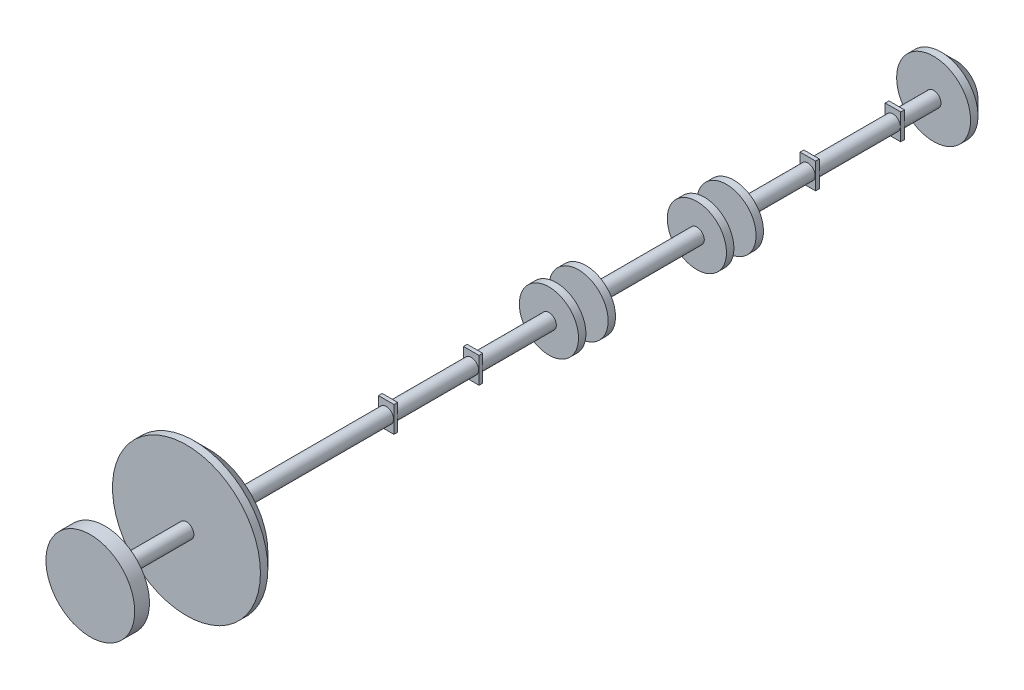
SolidWorks part; units mm, degrees
ref_plane "Plan de face" through (0, 0, 0) normal (0, 0, 1) x (1, 0, 0)
ref_plane "Plan de dessus" through (0, 0, 0) normal (0, 1, 0) x (1, 0, 0)
ref_plane "Plan de droite" through (0, 0, 0) normal (1, 0, 0) x (0, 0, -1)
sketch "Esquisse1" plane through (0, 0, 0) normal (0, 0, 1) x (1, 0, 0)
  circle A0 centre (0, 0) radius 10
  dimension "D1" = 20
extrude "Extrusion1" add sketch "Esquisse1" along normal blind 240
sketch "Esquisse2" plane through (0, 0, 0) normal (0, 0, -1) x (-1, 0, 0)
  line L1 (-10.5, 17.5) -> (10.5, 17.5)
  line L2 (-10.5, 17.5) -> (-10.5, -17.5)
  line L3 (-10.5, -17.5) -> (10.5, -17.5)
  line L4 (10.5, 17.5) -> (10.5, -17.5)
  dimension "D1" = 21
  dimension "D2" = 10.5
  dimension "D3" = 35
  dimension "D4" = 17.5
extrude "Extrusion2" add sketch "Esquisse2" along normal blind 5
sketch "Esquisse3" plane through (0, 0, -5) normal (0, 0, -1) x (-1, 0, 0)
  circle A0 centre (0, 0) radius 10 construction
  circle A1 centre (0, 0) radius 10
extrude "Extrusion3" add sketch "Esquisse3" along normal blind 110
sketch "Esquisse4" plane through (0, 0, -115) normal (0, 0, -1) x (-1, 0, 0)
  line L4 (-10.5, 17.5) -> (-10.5, -17.5)
  line L5 (-10.5, -17.5) -> (10.5, -17.5)
  line L6 (10.5, -17.5) -> (10.5, 17.5)
  line L7 (10.5, 17.5) -> (-10.5, 17.5)
  line L8 (-10.5, 17.5) -> (-10.5, -17.5)
  line L9 (-10.5, -17.5) -> (10.5, -17.5)
  line L10 (10.5, -17.5) -> (10.5, 17.5)
  line L11 (10.5, 17.5) -> (-10.5, 17.5)
  dimension "D1" = 0
extrude "Extrusion4" add sketch "Esquisse4" along normal blind 5
sketch "Esquisse5" plane through (0, 0, -120) normal (0, 0, -1) x (-1, 0, 0)
  circle A0 centre (0, 0) radius 10 construction
  circle A1 centre (0, 0) radius 10
extrude "Extrusion5" add sketch "Esquisse5" along normal blind 100
sketch "Esquisse7" plane through (0, 0, 240) normal (0, 0, 1) x (1, 0, 0)
  circle A0 centre (0, 0) radius 100
  dimension "D1" = 200
extrude "Extrusion7" add sketch "Esquisse7" along normal blind 30
sketch "Esquisse10" plane through (0, 0, 270) normal (0, 0, 1) x (1, 0, 0)
  circle A0 centre (0, 0) radius 10 construction
  circle A1 centre (0, 0) radius 10
extrude "Extrusion8" add sketch "Esquisse10" along normal blind 110
sketch "Esquisse11" plane through (0, 0, 380) normal (0, 0, 1) x (1, 0, 0)
  circle A0 centre (0, 0) radius 60
  dimension "D1" = 120
extrude "Extrusion9" add sketch "Esquisse11" along normal blind 20
sketch "Esquisse12" plane through (0, 0, -220) normal (0, 0, -1) x (-1, 0, 0)
  circle A0 centre (0, 0) radius 40
  dimension "D1" = 80
extrude "Extrusion10" add sketch "Esquisse12" along normal blind 10
sketch "Esquisse13" plane through (0, 0, -230) normal (0, 0, -1) x (-1, 0, 0)
  circle A0 centre (0, 0) radius 10 construction
  circle A1 centre (0, 0) radius 10
extrude "Extrusion11" add sketch "Esquisse13" along normal blind 30
sketch "Esquisse14" plane through (0, 0, -260) normal (0, 0, -1) x (-1, 0, 0)
  circle A0 centre (0, 0) radius 40 construction
  circle A1 centre (0, 0) radius 40
extrude "Extrusion12" add sketch "Esquisse14" along normal blind 10
sketch "Esquisse15" plane through (0, 0, -270) normal (0, 0, -1) x (-1, 0, 0)
  circle A0 centre (0, 0) radius 10 construction
  circle A1 centre (0, 0) radius 10
extrude "Extrusion13" add sketch "Esquisse15" along normal blind 150
sketch "Esquisse16" plane through (0, 0, -420) normal (0, 0, -1) x (-1, 0, 0)
  circle A0 centre (0, 0) radius 40 construction
  circle A1 centre (0, 0) radius 40
extrude "Extrusion14" add sketch "Esquisse16" along normal blind 10
sketch "Esquisse17" plane through (0, 0, -430) normal (0, 0, -1) x (-1, 0, 0)
  circle A0 centre (0, 0) radius 10 construction
  circle A1 centre (0, 0) radius 10
extrude "Extrusion15" add sketch "Esquisse17" along normal blind 30
sketch "Esquisse18" plane through (0, 0, -460) normal (0, 0, -1) x (-1, 0, 0)
  circle A0 centre (0, 0) radius 40 construction
  circle A1 centre (0, 0) radius 40
extrude "Extrusion16" add sketch "Esquisse18" along normal blind 10
sketch "Esquisse19" plane through (0, 0, -470) normal (0, 0, -1) x (-1, 0, 0)
  circle A0 centre (0, 0) radius 10 construction
  circle A1 centre (0, 0) radius 10
extrude "Extrusion17" add sketch "Esquisse19" along normal blind 100
sketch "Esquisse20" plane through (0, 0, -570) normal (0, 0, -1) x (-1, 0, 0)
  line L4 (10.5, 17.5) -> (-10.5, 17.5)
  line L5 (-10.5, 17.5) -> (-10.5, -17.5)
  line L6 (-10.5, -17.5) -> (10.5, -17.5)
  line L7 (10.5, -17.5) -> (10.5, 17.5)
  line L8 (10.5, 17.5) -> (-10.5, 17.5)
  line L9 (-10.5, 17.5) -> (-10.5, -17.5)
  line L10 (-10.5, -17.5) -> (10.5, -17.5)
  line L11 (10.5, -17.5) -> (10.5, 17.5)
  dimension "D1" = 0
extrude "Extrusion18" add sketch "Esquisse20" along normal blind 5
sketch "Esquisse21" plane through (0, 0, -575) normal (0, 0, -1) x (-1, 0, 0)
  circle A0 centre (0, 0) radius 10 construction
  circle A1 centre (0, 0) radius 10
extrude "Extrusion19" add sketch "Esquisse21" along normal blind 110
sketch "Esquisse22" plane through (0, 0, -685) normal (0, 0, -1) x (-1, 0, 0)
  line L4 (10.5, -17.5) -> (10.5, 17.5)
  line L5 (10.5, 17.5) -> (-10.5, 17.5)
  line L6 (-10.5, 17.5) -> (-10.5, -17.5)
  line L7 (-10.5, -17.5) -> (10.5, -17.5)
  line L8 (10.5, -17.5) -> (10.5, 17.5)
  line L9 (10.5, 17.5) -> (-10.5, 17.5)
  line L10 (-10.5, 17.5) -> (-10.5, -17.5)
  line L11 (-10.5, -17.5) -> (10.5, -17.5)
  dimension "D1" = 0
extrude "Extrusion20" add sketch "Esquisse22" along normal blind 5
sketch "Esquisse23" plane through (0, 0, -690) normal (0, 0, -1) x (-1, 0, 0)
  circle A0 centre (0, 0) radius 10 construction
  circle A1 centre (0, 0) radius 10
extrude "Extrusion21" add sketch "Esquisse23" along normal blind 50
sketch "Esquisse24" plane through (0, 0, -740) normal (0, 0, -1) x (-1, 0, 0)
  circle A0 centre (0, 0) radius 50
  dimension "D1" = 100
extrude "Extrusion22" add sketch "Esquisse24" along normal blind 30
chamfer "Chanfrein3" distance 20 angle 45 1 edges at (-50, 0, -770)
sketch "Esquisse25" plane through (0, 0, 0) normal (0, 1, 0) x (1, 0, 0)
  line L0 (40, 430) -> (-40, 430) construction
  line L1 (-40, 460) -> (40, 460)
  line L2 (-40, 460) -> (-40, 430)
  line L3 (-40, 430) -> (40, 430)
  line L4 (40, 460) -> (40, 430)
  line L5 (40, 230) -> (-40, 230) construction
  line L6 (-40, 260) -> (40, 260)
  line L7 (-40, 260) -> (-40, 230)
  line L8 (-40, 230) -> (40, 230)
  line L9 (40, 260) -> (40, 230)
extrude "Enlèv. mat.-Extru.1" cut sketch "Esquisse25" against normal through all and the other way through all
sketch "Esquisse26" plane through (0, 0, 0) normal (1, 0, 0) x (0, 0, -1)
  line L0 (770, 0) -> (850, 0) construction
  line L1 (770, -30) -> (770, 30) construction
  dimension "D1" = 80
chamfer "Chanfrein4" distance 20 angle 45 1 edges at (100, 0, 240)
sketch "Esquisse27" plane through (0, 0, 0) normal (1, 0, 0) x (0, 0, -1)
  line L0 (-240, 0) -> (-210, 0) construction
  line L2 (-240, -80) -> (-240, 80) construction
  dimension "D1" = 30
